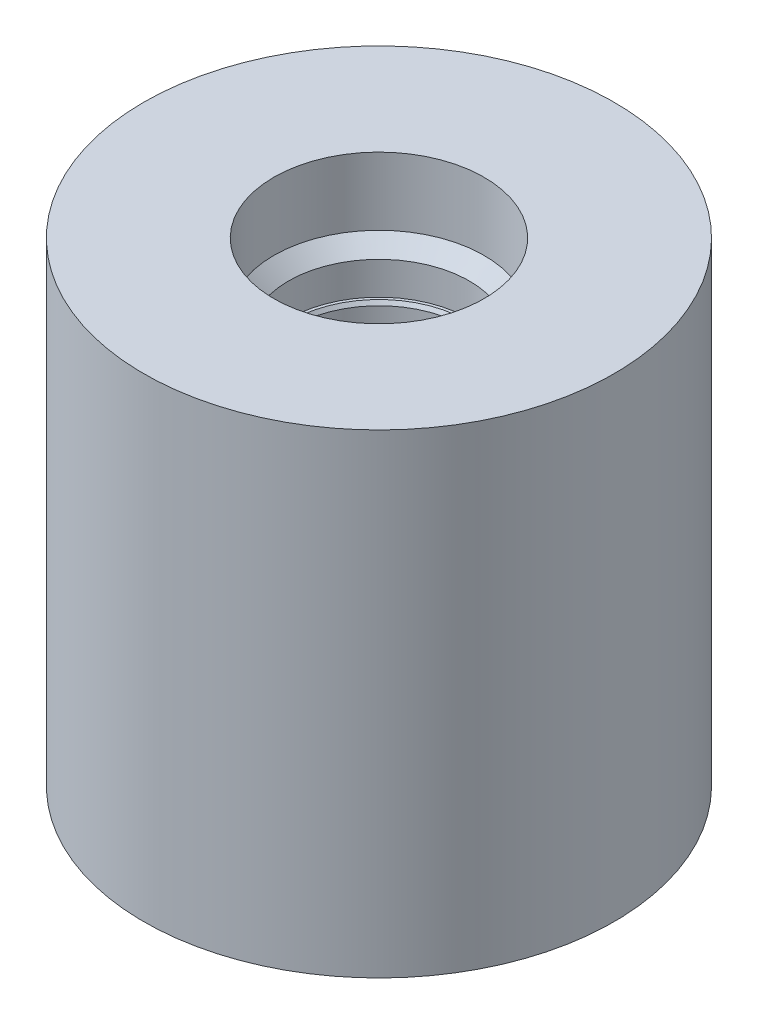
SolidWorks part; units mm, degrees
ref_plane "Ebene vorne" through (0, 0, 0) normal (0, 0, 1) x (1, 0, 0)
ref_plane "Ebene oben" through (0, 0, 0) normal (0, 1, 0) x (1, 0, 0)
ref_plane "Ebene rechts" through (0, 0, 0) normal (1, 0, 0) x (0, 0, -1)
sketch "Skizze1" plane through (0, 0, 0) normal (0, 0, 1) x (1, 0, 0)
  line L0 (5.3016, 599.2529) -> (3.436, 599.2529)
  line L1 (5.3016, 600.9515) -> (5.3016, 594.9626) construction
  line L2 (1.1246, 639.1182) -> (1.4675, 639.1182)
  line L3 (12.0466, 653.036) -> (12.0466, 595.7226) construction
  line L4 (-0.6534, 653.036) -> (-16.3523, 653.036)
  line L5 (-16.3523, 653.036) -> (-16.3523, 595.7226)
  line L6 (-16.3523, 595.7226) -> (5.3016, 595.7226)
  line L7 (5.3016, 599.2529) -> (5.3016, 595.7226)
  line L471 (2.7502, 634.1399) -> (1.7342, 635.1559)
  line L477 (1.1246, 643.0807) -> (1.1246, 639.1182)
  line L481 (-0.6534, 644.8587) -> (1.1246, 643.0807)
  line L482 (-0.6534, 644.8587) -> (-0.6534, 653.036)
  line L485 (2.7502, 606.9619) -> (2.7502, 634.1399)
  line L489 (3.3091, 599.3799) -> (3.436, 599.2529)
  line L490 (3.3091, 606.4031) -> (2.7502, 606.9619)
  line L491 (3.3091, 606.4031) -> (3.3091, 599.3799)
  line L497 (1.7342, 638.6564) -> (1.7342, 635.1559)
  line L498 (1.7342, 638.6564) -> (1.4675, 639.1182)
  dimension "D1" = 6.745
revolve "Rotation9" add sketch "Skizze1" angle 360 about L3
